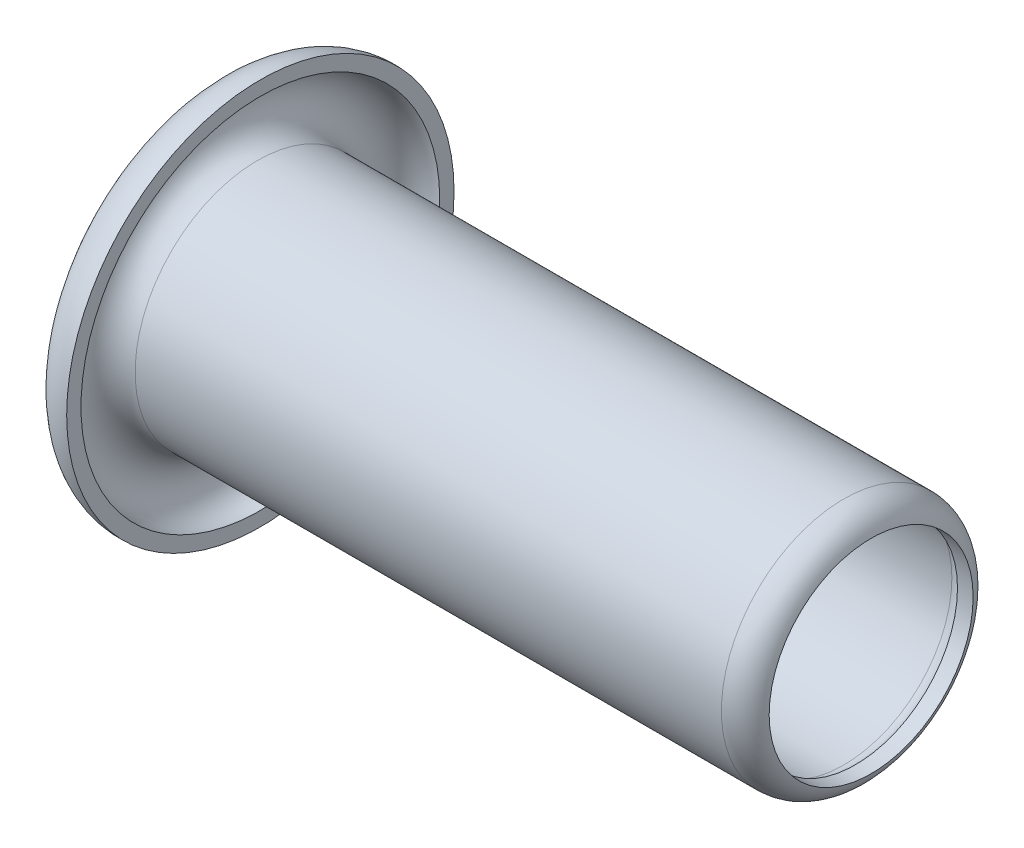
SolidWorks part; units mm, degrees
ref_plane "Front" through (0, 0, 0) normal (0, 0, 1) x (1, 0, 0)
ref_plane "Top" through (0, 0, 0) normal (0, 1, 0) x (1, 0, 0)
ref_plane "Right" through (0, 0, 0) normal (1, 0, 0) x (0, 0, -1)
sketch "Sketch1" plane through (2.0982, 0.9018, 0) normal (0, 0, 1) x (0, 1, 0)
  line L0 (3.4947, 0.9782) -> (3.8459, 0.9782)
  line L1 (2.0982, 1.0482) -> (2.0982, -13.3218)
  line L2 (1.3982, -14.0218) -> (-0.9018, -14.0218)
  line L3 (1.7482, -13.3218) -> (1.7482, 1.0482)
  line L4 (-0.9018, -14.0218) -> (-0.9018, 3) construction
  line L5 (2.7982, 2.0982) -> (-0.9398, 2.0982) construction
  line L6 (1.3982, -13.6718) -> (-0.9018, -13.6718)
  line L7 (-0.9018, -13.6718) -> (-0.9018, -14.0218)
  arc A0 (3.4947, 0.9782) -> (2.0982, 1.0482) centre (2.7982, 1.0482) ccw
  arc A1 (3.8459, 0.9782) -> (1.7482, 1.0482) centre (2.7982, 1.0482) ccw
  arc A2 (1.3982, -13.6718) -> (1.7482, -13.3218) centre (1.3982, -13.3218) ccw
  arc A3 (2.0982, -13.3218) -> (1.3982, -14.0218) centre (1.3982, -13.3218) cw
  dimension "r" = 0.7
  dimension "D1" = 0.35
  dimension "D2" = 0.35
  dimension "d" = 6
  dimension "l" = 15
  dimension "K" = 1.12
  dimension "δ" = 0.35
revolve "Base-Revolve" add sketch "Sketch1" angle 360 about L4
sketch "Sketch2" plane through (0, 0, 0) normal (0, 0, 1) x (1, 0, 0)
  line L0 (0, 0) -> (17.7089, 0) construction
  line L1 (16.12, -2.3) -> (16.12, 2.3) construction
  line L2 (16.62, 0) -> (14.92, 0)
  line L3 (16.62, 0) -> (16.62, 2.5)
  line L4 (16.62, 2.5) -> (14.92, 2.5)
  line L5 (14.92, 0) -> (14.92, 2.5)
  line L6 (15.42, 3) -> (15.42, -3) construction
  dimension "D1" = 0.5
  dimension "D2" = 0.5
  dimension "dt" = 5
revolve "Cut-Revolve1" cut sketch "Sketch2" angle 360 about L0
equation "\"D1@Sketch1\" = \"δ@Sketch1\""
equation "\"D2@Sketch1\" = \"D1@Sketch1\""
